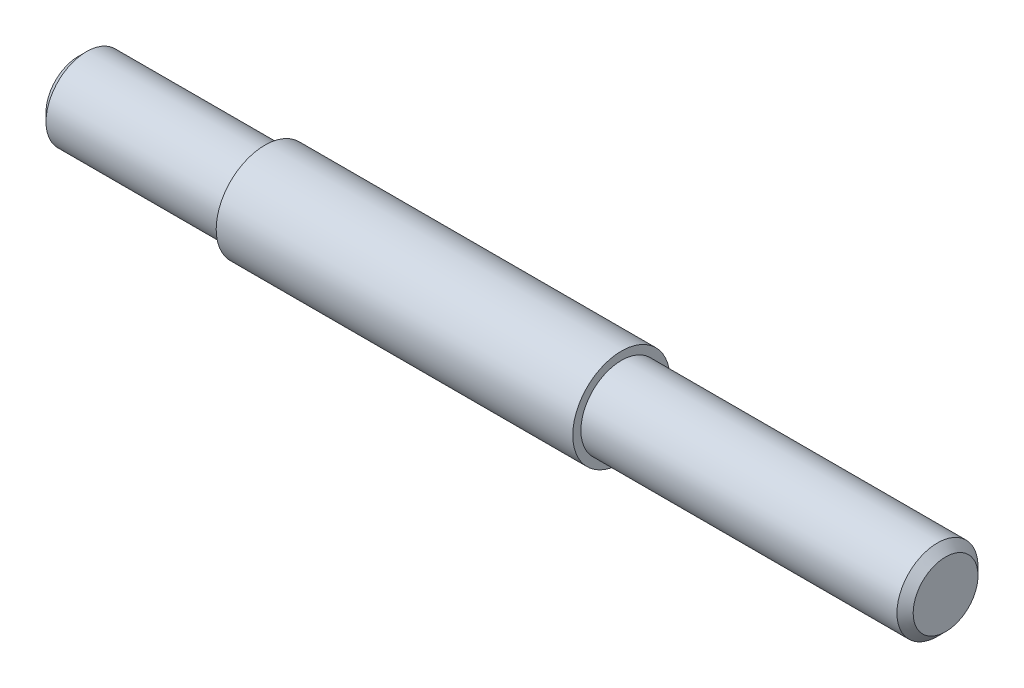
SolidWorks part; units mm, degrees
ref_plane "Face" through (0, 0, 0) normal (0, 0, 1) x (1, 0, 0)
ref_plane "Dessus" through (0, 0, 0) normal (0, 1, 0) x (1, 0, 0)
ref_plane "Droite" through (0, 0, 0) normal (1, 0, 0) x (0, 0, -1)
sketch "Esquisse1" plane through (0, 0, 0) normal (0, 0, 1) x (1, 0, 0)
  line L0 (0, 0) -> (0, 5)
  line L1 (0, 5) -> (23, 5)
  line L2 (23, 5) -> (23, 6)
  line L3 (23, 6) -> (67, 6)
  line L4 (67, 6) -> (67, 5)
  line L5 (67, 5) -> (107, 5)
  line L6 (107, 5) -> (107, 0)
  line L7 (107, 0) -> (0, 0)
  line L8 (-12.1886, 0) -> (111.9475, 0) construction
  dimension "D1" = 23
  dimension "D2" = 40
  dimension "D3" = 44
  dimension "D4" = 5
  dimension "D5" = 5
  dimension "D6" = 6
revolve "Révolution1" add sketch "Esquisse1" angle 360 about L8
chamfer "Chanfrein1" distance 1 angle 45
